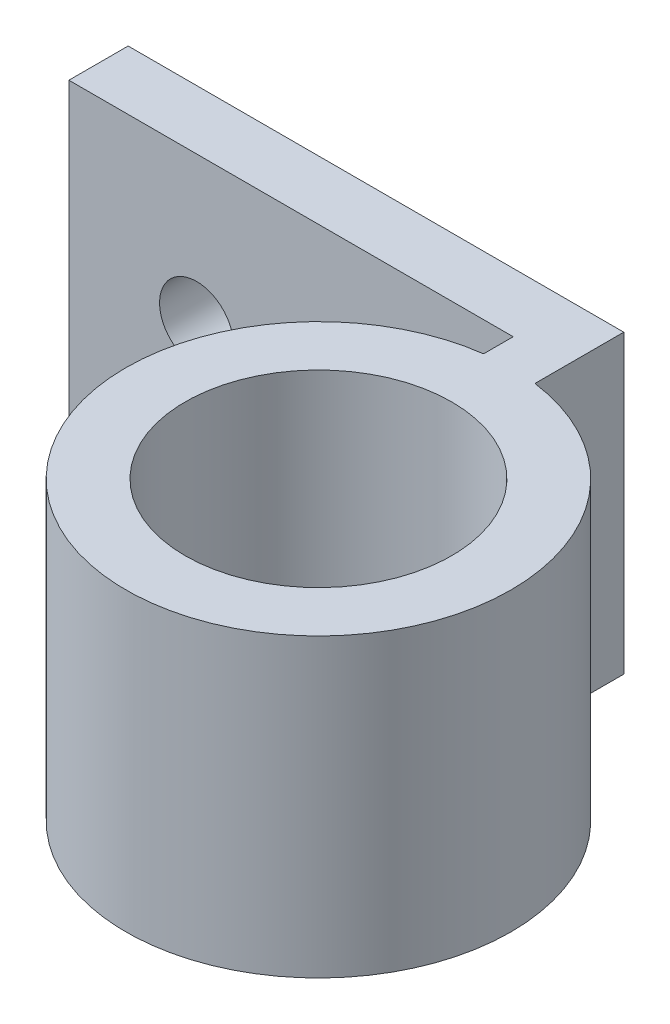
SolidWorks part; units mm, degrees
ref_plane "Front Plane" through (0, 0, 0) normal (0, 0, 1) x (1, 0, 0)
ref_plane "Top Plane" through (0, 0, 0) normal (0, 1, 0) x (1, 0, 0)
ref_plane "Right Plane" through (0, 0, 0) normal (1, 0, 0) x (0, 0, -1)
sketch "Sketch1" plane through (0, 0, 0) normal (0, 1, 0) x (1, 0, 0)
  line L2 (-0.8667, 6.442) -> (-0.8667, 7.442)
  line L4 (0.8667, 6.442) -> (0.8667, 7.442)
  line L6 (-15.8667, 9.442) -> (-15.8667, 7.442)
  line L7 (-15.8667, 7.442) -> (-0.8667, 7.442)
  line L9 (-15.8667, 9.442) -> (0.8667, 9.442)
  line L10 (0.8667, 9.442) -> (0.8667, 7.442)
  circle A0 centre (0, 0) radius 4.5
  arc A1 (-0.8667, 6.442) -> (0.8667, 6.442) centre (0, 0) ccw
  circle A2 centre (0, 0) radius 6.5 construction
  dimension "D1" = 9
  dimension "D3" = 1
  dimension "D5" = 2
  dimension "D6" = 15
  dimension "D2" = 2
extrude "Boss-Extrude1" add sketch "Sketch1" along normal blind 10
sketch "Sketch2" plane through (0, 0, -7.442) normal (0, 0, 1) x (1, 0, 0)
  circle A0 centre (-11.5556, 5.0228) radius 1.25
  point P2 (0, 0)
  point P3 (-11.5556, 5.0228)
  dimension "D1" = 2.5
extrude "Cut-Extrude1" cut sketch "Sketch2" against normal blind 10
